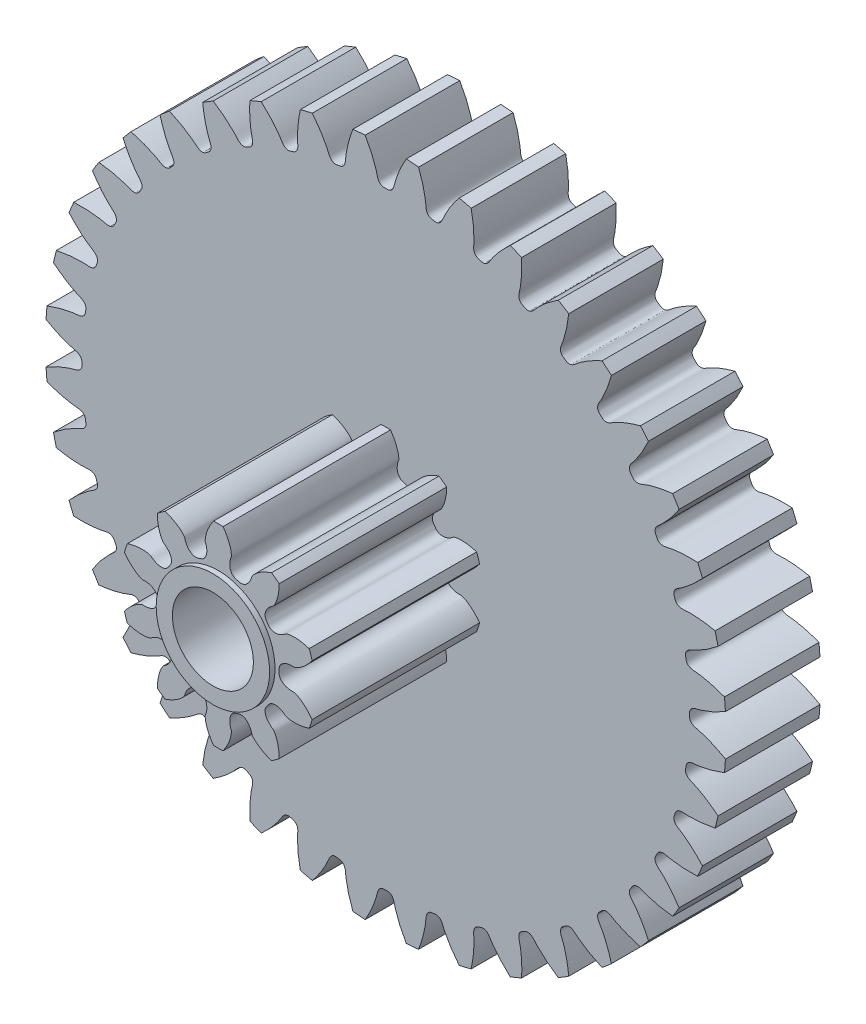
SolidWorks part; units mm, degrees
ref_plane "Front Plane" through (0, 0, 0) normal (0, 0, 1) x (1, 0, 0)
ref_plane "Top Plane" through (0, 0, 0) normal (0, 1, 0) x (1, 0, 0)
ref_plane "Right Plane" through (0, 0, 0) normal (1, 0, 0) x (0, 0, -1)
imported_body "STD_GB - Spur gear 0.6M 40T 20PA 3.5FW-1-solid1"
imported_body "STD_GB - Spur gear 0.6M 10T 20PA 3.5FW-1-solid1"
sketch "Sketch1" plane through (0, 0, 7.7838) normal (0, 0, -1) x (-1, 0, 0)
  circle A2 centre (-8.0265, 4.7504) radius 1.5 construction
  circle A3 centre (-8.0265, 4.7504) radius 1.5
extrude "Boss-Extrude1" add sketch "Sketch1" against normal up to surface (9.7 mm away)
sketch "Sketch2" plane through (0, 0, 17.4838) normal (0, 0, 1) x (1, 0, 0)
  circle A0 centre (8.0265, 4.7504) radius 1.5
  dimension "D1" = 3
extrude "Cut-Extrude1" cut sketch "Sketch2" against normal blind 10
sketch "Sketch3" plane through (0, 0, 17.4838) normal (0, 0, 1) x (1, 0, 0)
  circle A0 centre (8.0265, 4.7504) radius 1.5 construction
  circle A1 centre (8.0265, 4.7504) radius 1.5
  circle A2 centre (8.0265, 4.7504) radius 2.1
  dimension "D1" = 4.2
extrude "Boss-Extrude2" add sketch "Sketch3" along normal blind 0.2
sketch "Sketch4" plane through (0, 0, 7.7838) normal (0, 0, -1) x (-1, 0, 0)
  circle A0 centre (-8.0265, 4.7504) radius 3
  circle A1 centre (-8.0265, 4.7504) radius 1.5 construction
  circle A2 centre (-8.0265, 4.7504) radius 1.5
  dimension "D1" = 6
extrude "Boss-Extrude3" add sketch "Sketch4" along normal blind 0.5
sketch "Sketch5" plane through (0, 0, 11.2838) normal (0, 0, 1) x (1, 0, 0)
  line L0 (8.0265, 4.7504) -> (8.0265, 16.0004) construction
  line L1 (8.0265, 4.7504) -> (14.6391, 13.8518) construction
  line L2 (8.0265, 4.7504) -> (18.7259, 8.2268) construction
  line L3 (8.0265, 4.7504) -> (18.7259, 1.2739) construction
  line L4 (8.0265, 4.7504) -> (14.6391, -4.3511) construction
  line L5 (8.0265, 4.7504) -> (8.0265, -6.4996) construction
  line L6 (8.0265, 4.7504) -> (1.4139, -4.3511) construction
  line L7 (8.0265, 4.7504) -> (-2.6729, 1.2739) construction
  line L8 (8.0265, 4.7504) -> (-2.6729, 8.2268) construction
  line L9 (8.0265, 4.7504) -> (1.4139, 13.8518) construction
  spline S0 degree 3 poles (7.2656, 17.3274) (7.312, 17.2469) (7.3833, 17.1158) (7.4713, 16.9353) (7.5344, 16.7938) (7.5873, 16.6628) (7.631, 16.543) (7.6612, 16.4501) (7.6814, 16.3818) (7.6943, 16.3352) (7.7112, 16.2706) (7.7236, 16.2113) (7.7435, 16.1599) (7.7561, 16.1332) (7.7718, 16.1064) (7.7922, 16.079) (7.8198, 16.0511) (7.8577, 16.0245) (7.9055, 16.0055) (7.9637, 15.9981) (8.0265, 16.0016) (8.0893, 15.9981) (8.1475, 16.0055) (8.1953, 16.0245) (8.2332, 16.0511) (8.2608, 16.079) (8.2812, 16.1064) (8.2969, 16.1332) (8.3095, 16.1599) (8.3294, 16.2113) (8.3419, 16.2706) (8.3587, 16.3352) (8.3716, 16.3818) (8.3977, 16.4699) (8.4362, 16.5843) (8.491, 16.7269) (8.5489, 16.8633) (8.6173, 17.0099) (8.697, 17.1664) (8.7559, 17.2727) (8.7874, 17.3274) knots 0 0 0 0 0.086166 0.138307 0.186206 0.229863 0.269278 0.30445 0.320446 0.335381 0.349255 0.382407 0.391306 0.400314 0.40975 0.420076 0.431925 0.446011 0.462732 0.479069 0.5 0.520931 0.537268 0.553989 0.568075 0.579924 0.59025 0.599686 0.608694 0.617593 0.650745 0.664619 0.679554 0.69555 0.7499 0.791435 0.837213 0.887233 0.941496 1 1 1 1 construction
  point P17 (8.0265, 4.7504)
  dimension "D1" = 10
